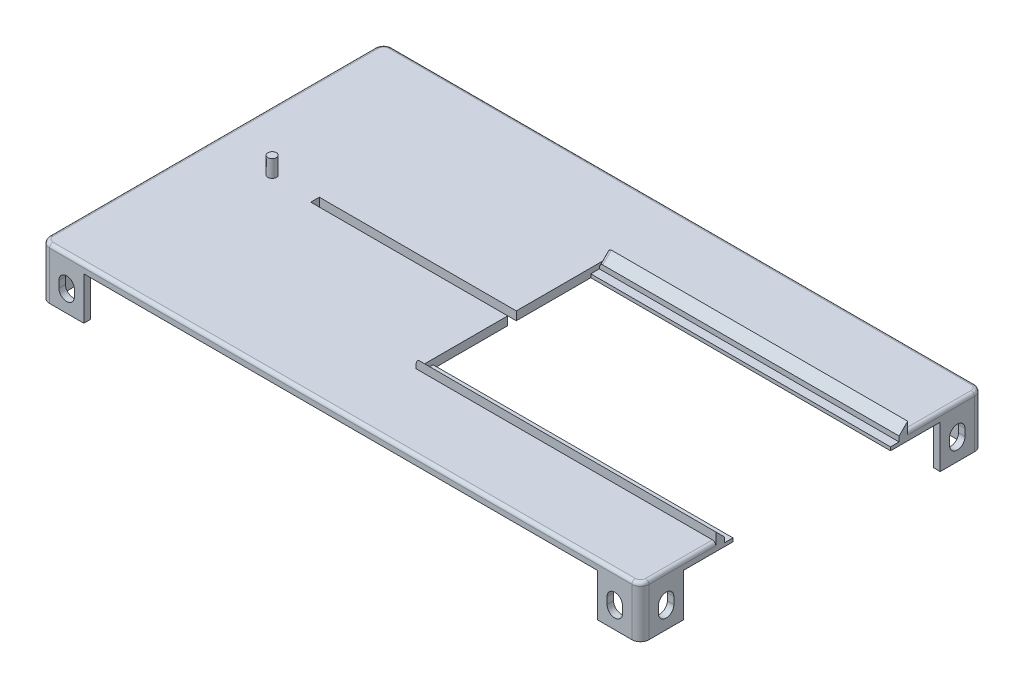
SolidWorks part; units mm, degrees
ref_plane "Alzado" through (0, 0, 0) normal (0, 0, 1) x (1, 0, 0)
ref_plane "Planta" through (0, 0, 0) normal (0, 1, 0) x (1, 0, 0)
ref_plane "Vista lateral" through (0, 0, 0) normal (1, 0, 0) x (0, 0, -1)
sketch "Croquis2" plane through (0, 0, 0) normal (0, 1, 0) x (1, 0, 0)
  line L1 (-175, -100) -> (175, -100)
  line L2 (-175, -100) -> (-175, 100)
  line L3 (-175, 100) -> (175, 100)
  line L4 (175, -100) -> (175, 100)
  line L5 (-175, -100) -> (175, 100) construction
  line L6 (-175, 100) -> (175, -100) construction
  point P0 (0, 0)
  dimension "D1" = 200
  dimension "D2" = 350
extrude "Saliente-Extruir1" add sketch "Croquis2" along normal blind 5
sketch "Croquis3" plane through (0, 5, 0) normal (0, 1, 0) x (1, 0, 0)
  line L0 (0, 0) -> (0, -51)
  line L1 (0, -51) -> (175, -51)
  line L2 (175, -100) -> (175, 100) construction
  line L3 (0, 0) -> (0, 51)
  line L4 (0, 51) -> (175, 51)
  line L5 (175, 51) -> (175, -51)
  dimension "D1" = 51
  dimension "D2" = 175
extrude "Cortar-Extruir1" cut sketch "Croquis3" against normal blind 3
sketch "Croquis4" plane through (0, 2, 0) normal (0, 1, 0) x (1, 0, 0)
  line L0 (0, 0) -> (0, -46) construction
  line L1 (0, 51) -> (0, -51) construction
  line L2 (175, -51) -> (175, 51) construction
  line L3 (0, -46) -> (175, -46)
  line L4 (0, -46) -> (0, 46)
  line L5 (0, 46) -> (175, 46)
  line L6 (175, -46) -> (175, 46)
  point P10 (0, 0)
  dimension "D1" = 5
  dimension "D2" = 5
  dimension "D3" = 92
extrude "Cortar-Extruir2" cut sketch "Croquis4" against normal blind 2 contours L4 L3 L6 L5
sketch "Croquis5" plane through (175, 0, 0) normal (1, 0, 0) x (0, 0, -1)
  line L0 (-51, 5) -> (-56, 5)
  line L1 (-100, 5) -> (-51, 5) construction
  line L2 (-56, 5) -> (-56, 10)
  line L3 (-56, 10) -> (-51, 5)
  line L4 (0, 2.75) -> (0, -2.75) construction
  line L5 (56, 5) -> (56, 10)
  line L6 (51, 5) -> (56, 5)
  line L7 (56, 10) -> (51, 5)
extrude "Saliente-Extruir3" add sketch "Croquis5" against normal blind 175
sketch "Croquis7" plane through (0, 0, 0) normal (0, -1, 0) x (1, 0, 0)
  line L0 (175, -100) -> (150, -100)
  line L1 (175, -100) -> (-175, -100) construction
  line L2 (175, -100) -> (175, -75)
  line L3 (175, -46) -> (175, -100) construction
  line L4 (150, -100) -> (150, -96.2)
  line L5 (175, -75) -> (171.2, -75)
  line L6 (171.2, -75) -> (171.2, -96.2)
  line L7 (171.2, -96.2) -> (150, -96.2)
  line L8 (0, -5.5) -> (0, 5.5) construction
  line L9 (-171.2, -75) -> (-171.2, -96.2)
  line L10 (-175, -75) -> (-171.2, -75)
  line L11 (-175, -100) -> (-175, -75)
  line L12 (-175, -100) -> (-150, -100)
  line L13 (-150, -100) -> (-150, -96.2)
  line L14 (-171.2, -96.2) -> (-150, -96.2)
  line L15 (5.5, 0) -> (-5.5, 0) construction
  line L16 (-175, 75) -> (-171.2, 75)
  line L17 (-175, 100) -> (-175, 75)
  line L18 (-175, 100) -> (-150, 100)
  line L19 (-150, 100) -> (-150, 96.2)
  line L20 (-171.2, 96.2) -> (-150, 96.2)
  line L21 (-171.2, 75) -> (-171.2, 96.2)
  line L22 (171.2, 75) -> (171.2, 96.2)
  line L23 (175, 75) -> (171.2, 75)
  line L24 (175, 100) -> (175, 75)
  line L25 (175, 100) -> (150, 100)
  line L26 (150, 100) -> (150, 96.2)
  line L27 (171.2, 96.2) -> (150, 96.2)
extrude "Saliente-Extruir4" add sketch "Croquis7" along normal blind 25
fillet "Redondeo1" radius 5 4 edges at (175, -10, 100) (-175, -10, 100) (-175, -10, -100) (175, -10, -100)
fillet "Redondeo2" radius 2 8 edges at (0, 5, 100) (-173.5355, 5, 98.5355) (-175, 5, 0) (-173.5355, 5, -98.5355) (0, 5, -100) (173.5355, 5, -98.5355) (175, 5, 75.5) (173.5355, 5, 98.5355)
sketch "Croquis8" plane through (0, 0, 100) normal (0, 0, 1) x (1, 0, 0)
  line L0 (160, -25) -> (160, -12.5) construction
  line L1 (170, -25) -> (150, -25) construction
  line L2 (160, -14.5) -> (160, -10.5) construction
  line L4 (155.5, -14.5) -> (155.5, -10.5)
  line L5 (164.5, -14.5) -> (164.5, -10.5)
  arc A2 (155.5, -14.5) -> (164.5, -14.5) centre (160, -14.5) ccw
  arc A3 (164.5, -10.5) -> (155.5, -10.5) centre (160, -10.5) ccw
  point P4 (162.5, -5.3388)
  point P11 (160, -12.5)
  dimension "D1" = 4
  dimension "D2" = 4.5
  dimension "D3" = 12.5
extrude "Cortar-Extruir3" cut sketch "Croquis8" against normal blind 4
mirror "Simetría1" about plane through (0, 0, 0) normal (1, 0, 0) of "Cortar-Extruir3"
mirror "Simetría2" about plane through (0, 0, 0) normal (0, 0, 1) of "Simetría1", "Cortar-Extruir3"
sketch "Croquis9" plane through (175, 0, 0) normal (1, 0, 0) x (0, 0, -1)
  line L0 (-85, -25) -> (-85, -12.5) construction
  line L1 (-75, -25) -> (-95, -25) construction
  line L2 (-85, -14.5238) -> (-85, -10.4762) construction
  line L3 (-89.5, -14.5238) -> (-89.5, -10.4762)
  line L4 (-80.5, -14.5238) -> (-80.5, -10.4762)
  arc A0 (-89.5, -14.5238) -> (-80.5, -14.5238) centre (-85, -14.5238) ccw
  arc A1 (-80.5, -10.4762) -> (-89.5, -10.4762) centre (-85, -10.4762) ccw
  point P6 (-85, -12.5)
  dimension "D1" = 4.5
extrude "Cortar-Extruir4" cut sketch "Croquis9" against normal blind 4
mirror "Simetría3" about plane through (0, 0, 0) normal (0, 0, 1) of "Cortar-Extruir4"
mirror "Simetría4" about plane through (0, 0, 0) normal (1, 0, 0) of "Cortar-Extruir4"
fillet "Redondeo3" radius 2 2 edges at (0, 7.5, -53.5) (0, 7.5, 53.5)
sketch "Croquis11" plane through (0, 5, 0) normal (0, 1, 0) x (1, 0, 0)
  line L0 (0, 0) -> (-102, 0) construction
  line L1 (0, 0) -> (-140, 0) construction
  circle A0 centre (-140, 0) radius 2.5
  dimension "D1" = 5
extrude "Saliente-Extruir5" add sketch "Croquis11" along normal blind 10
sketch "Croquis12" plane through (0, 5, 0) normal (0, 1, 0) x (1, 0, 0)
  line L0 (0, -2.5) -> (0, 2.5)
  line L1 (0, 53.8284) -> (0, -53.8284) construction
  line L2 (0, 2.5) -> (-115, 2.5)
  line L3 (-115, 2.5) -> (-115, -2.5)
  line L4 (-115, -2.5) -> (0, -2.5)
  point P6 (0, 0)
  dimension "D1" = 2.5
  dimension "D2" = 115
extrude "Cortar-Extruir5" cut sketch "Croquis12" against normal blind 10
